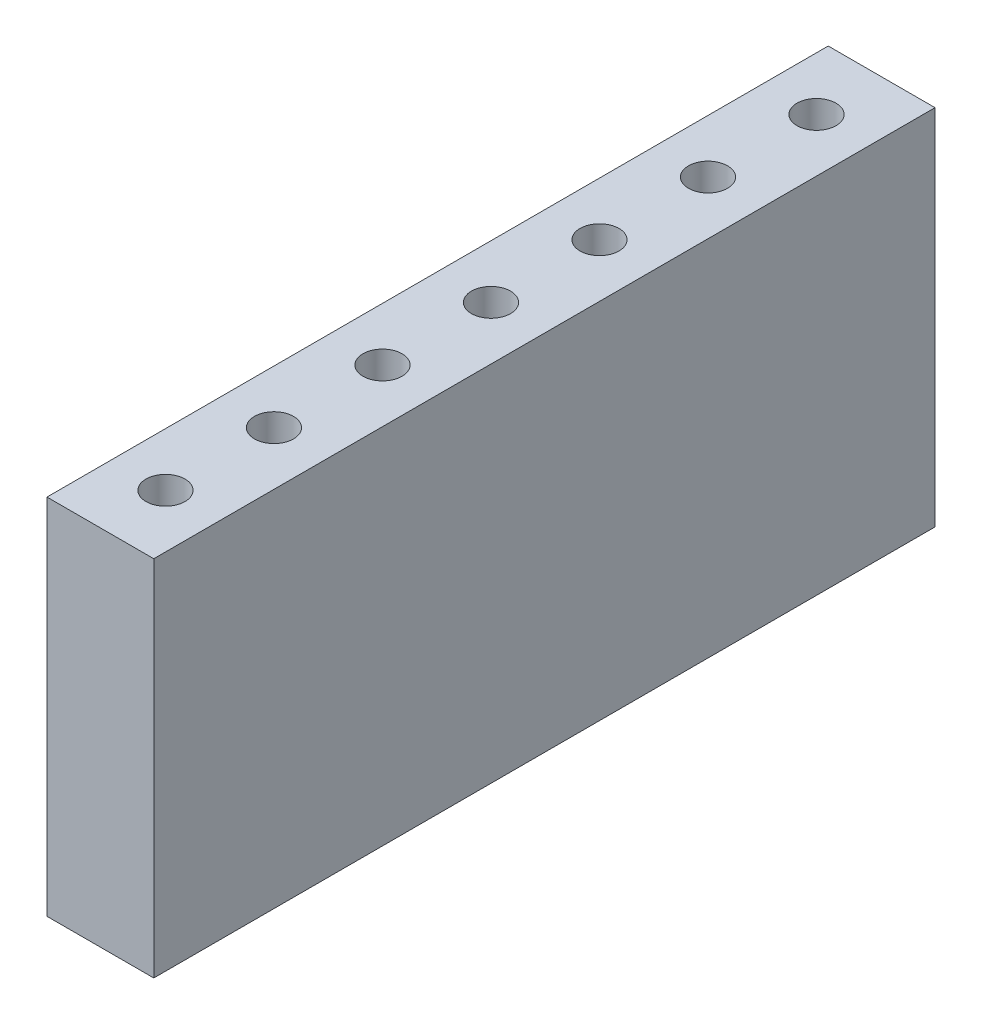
SolidWorks part; units mm, degrees
ref_plane "Front Plane" through (0, 0, 0) normal (0, 0, 1) x (1, 0, 0)
ref_plane "Top Plane" through (0, 0, 0) normal (0, 1, 0) x (1, 0, 0)
ref_plane "Right Plane" through (0, 0, 0) normal (1, 0, 0) x (0, 0, -1)
sketch "Sketch1" plane through (0, 0, 0) normal (0, 1, 0) x (1, 0, 0)
  line L0 (1.25, 18.288) -> (1.25, 0) construction
  line L1 (0, 0) -> (2.5, 0)
  line L2 (0, 0) -> (0, 18.288)
  line L3 (0, 18.288) -> (2.5, 18.288)
  line L4 (2.5, 0) -> (2.5, 18.288)
  line L5 (0, 9.144) -> (2.5, 9.144) construction
  dimension "D1" = 18.288
  dimension "D2" = 2.5
extrude "Extrude1" add sketch "Sketch1" along normal blind 8.5
sketch "Sketch2" plane through (0, 8.5, 0) normal (0, 1, 0) x (-1, 0, 0)
  line L0 (-1.25, 0) -> (-1.25, -18.288) construction
  line L3 (0, 0) -> (-2.5, 0) construction
  line L6 (-2.5, -18.288) -> (0, -18.288) construction
  circle A0 centre (-1.25, -1.524) radius 0.4572
  circle A1 centre (-1.25, -4.064) radius 0.4572
  circle A2 centre (-1.25, -6.604) radius 0.4572
  circle A3 centre (-1.25, -9.144) radius 0.4572
  circle A4 centre (-1.25, -11.684) radius 0.4572
  circle A5 centre (-1.25, -14.224) radius 0.4572
  circle A6 centre (-1.25, -16.764) radius 0.4572
  dimension "D1" = 0.9144
  dimension "D2" = 1.524
  dimension "D3" = 2.54
extrude "Cut-Extrude1" cut sketch "Sketch2" against normal blind 6.38
sketch "Sketch3" plane through (0, 0, 0) normal (0, -1, 0) x (1, 0, 0)
  circle A2 centre (1.25, -1.524) radius 0.4572 construction
  point P0 (1.25, -1.524)
